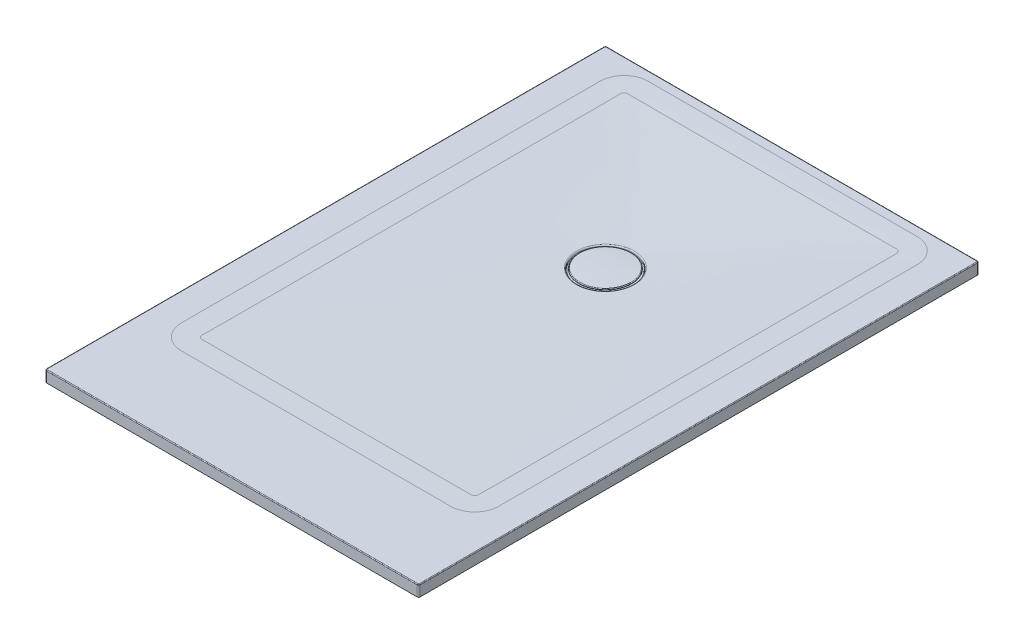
SolidWorks part; units mm, degrees
ref_plane "Płaszczyzna przednia" through (0, 0, 0) normal (0, 0, 1) x (1, 0, 0)
ref_plane "Płaszczyzna górna" through (0, 0, 0) normal (0, 1, 0) x (1, 0, 0)
ref_plane "Płaszczyzna prawa" through (0, 0, 0) normal (1, 0, 0) x (0, 0, -1)
sketch "Szkic2" plane through (0, 0, 0) normal (0, 1, 0) x (1, 0, 0)
  line L0 (0, 750) -> (0, 250) construction
  line L1 (-500, -750) -> (500, -750)
  line L2 (-500, -750) -> (-500, 750)
  line L3 (-500, 750) -> (500, 750)
  line L4 (500, -750) -> (500, 750)
  line L5 (-500, -750) -> (500, 750) construction
  line L6 (-500, 750) -> (500, -750) construction
  line L7 (-410, 710) -> (410, 710)
  line L8 (-410, 710) -> (-410, -510)
  line L9 (-410, -510) -> (410, -510)
  line L10 (410, 710) -> (410, -510)
  line L11 (-450, 750) -> (-450, -550) construction
  line L12 (-450, -550) -> (450, -550) construction
  line L13 (450, -550) -> (450, 750) construction
  circle A0 centre (0, 250) radius 75
  point P0 (0, 0)
  point P11 (0, 710)
  point P16 (0, -550)
  dimension "D9" = 150
  dimension "D1" = 1000
  dimension "D2" = 1500
  dimension "D3" = 40
  dimension "D4" = 90
  dimension "D5" = 40
  dimension "D6" = 50
  dimension "D7" = 1300
  dimension "D8" = 500
  dimension "D10" = 900
sketch "Szkic3" plane through (0, 0, 0) normal (0, 1, 0) x (1, 0, 0)
  line L0 (-500, -750) -> (-500, 750) construction
  line L1 (-500, -750) -> (500, -750) construction
  line L2 (500, -750) -> (500, 750) construction
  line L3 (-500, 750) -> (500, 750) construction
  line L4 (-410, 710) -> (-410, -510) construction
  line L5 (-410, 710) -> (410, 710) construction
  line L6 (410, 710) -> (410, -510) construction
  line L7 (-410, -510) -> (410, -510) construction
  line L8 (-500, -750) -> (-500, 750)
  line L9 (-500, -750) -> (500, -750)
  line L10 (500, -750) -> (500, 750)
  line L11 (-500, 750) -> (500, 750)
  line L12 (-410, 660) -> (-410, -460)
  line L13 (-360, 710) -> (360, 710)
  line L14 (410, 660) -> (410, -460)
  line L15 (-360, -510) -> (360, -510)
  arc A0 (410, 660) -> (360, 710) centre (360, 660) ccw
  arc A1 (-360, 710) -> (-410, 660) centre (-360, 660) ccw
  arc A2 (360, -510) -> (410, -460) centre (360, -460) ccw
  arc A3 (-360, -510) -> (-410, -460) centre (-360, -460) cw
  dimension "D1" = 50
surface "Powierzchnia-Płaszczyzna1" sketch "Szkic3"
sketch "Szkic4" plane through (0, 0, 0) normal (0, 1, 0) x (1, 0, 0)
  line L0 (-410, 710) -> (-410, -510) construction
  line L1 (-410, -510) -> (410, -510) construction
  line L2 (410, 710) -> (410, -510) construction
  line L3 (-410, 710) -> (410, 710) construction
  line L4 (-410, 710) -> (-410, -510)
  line L5 (-410, -510) -> (410, -510)
  line L6 (410, 710) -> (410, -510)
  line L7 (-410, 710) -> (410, 710)
ref_plane "korek" through (0, -15, 0) normal (0, 1, 0) x (-1, 0, 0)
sketch "Szkic5" plane through (0, -15, 0) normal (0, 1, 0) x (-1, 0, 0)
  circle A0 centre (0, -250) radius 75 construction
  circle A1 centre (0, -250) radius 75
surface "Powierzchnia-Wyciągnięcie po profilach2"
surface "Powierzchnia-Połącz1"
sketch "Szkic7" plane through (0, 0, 0) normal (0, 1, 0) x (1, 0, 0)
  line L27 (360, 670) -> (-360, 670)
  line L28 (-370, 660) -> (-370, -460)
  line L29 (-360, -470) -> (360, -470)
  line L30 (370, -460) -> (370, 660)
  line L31 (360, 670) -> (-360, 670)
  line L32 (-370, 660) -> (-370, -460)
  line L33 (-360, -470) -> (360, -470)
  line L34 (370, -460) -> (370, 660)
  line L35 (360, 725) -> (-360, 725)
  line L36 (-425, 660) -> (-425, -460)
  line L37 (-360, -525) -> (360, -525)
  line L38 (425, -460) -> (425, 660)
  line L39 (360, 725) -> (-360, 725)
  line L40 (-425, 660) -> (-425, -460)
  line L41 (-360, -525) -> (360, -525)
  line L42 (425, -460) -> (425, 660)
  arc A0 (370, -460) -> (360, -470) centre (360, -460) cw
  arc A1 (-370, -460) -> (-360, -470) centre (-360, -460) ccw
  arc A2 (370, 660) -> (360, 670) centre (360, 660) ccw
  arc A3 (-370, 660) -> (-360, 670) centre (-360, 660) cw
  spline S23 degree 3 poles (-592.8625, 390.015) (198.9197, 560.8421) (376.728, 627.1227) (369.7449, 662.2675) (369.6659, 662.5842) (369.4757, 663.212) (369.3642, 663.5241) (368.9881, 664.4319) (368.6814, 665.0061) (368.1377, 665.821) (367.9418, 666.0858) (367.5239, 666.5953) (367.3041, 666.8378) (366.6129, 667.5298) (366.1098, 667.9437) (365.2908, 668.4921) (365.007, 668.6624) (364.4301, 668.9711) (364.1356, 669.1106) (363.5345, 669.3602) (363.2279, 669.4704) (362.6025, 669.6609) (362.2822, 669.7416) (312.6399, 679.6772) (221.3123, 311.7847) (103.2556, -296.4722) knots -6.69122 -6.69122 -6.69122 -6.69122 0.125 0.125 0.1875 0.1875 0.25 0.25 0.375 0.375 0.4375 0.4375 0.5 0.5 0.625 0.625 0.6875 0.6875 0.75 0.75 0.8125 0.8125 0.875 0.875 10.419787 10.419787 10.419787 10.419787 only from (370, 660) to (360, 670)
  spline S24 degree 3 poles (-84.9957, -291.4411) (-254.1294, 479.995) (-325.4399, 677.0706) (-362.2675, 669.7449) (-362.5842, 669.6659) (-363.2121, 669.4758) (-363.5242, 669.3641) (-364.432, 668.9882) (-365.0061, 668.6813) (-366.0927, 667.9565) (-366.6073, 667.5346) (-367.5296, 666.6128) (-367.9435, 666.1098) (-368.492, 665.291) (-368.6623, 665.0071) (-368.9711, 664.4303) (-369.1105, 664.1357) (-369.3602, 663.5346) (-369.4703, 663.228) (-369.6609, 662.6026) (-369.7415, 662.2824) (-378.3024, 619.4425) (-108.4159, 545.9666) (601.6306, 423.5405) knots -7.020727 -7.020727 -7.020727 -7.020727 0.125 0.125 0.1875 0.1875 0.25 0.25 0.375 0.375 0.5 0.5 0.625 0.625 0.6875 0.6875 0.75 0.75 0.8125 0.8125 0.875 0.875 9.10244 9.10244 9.10244 9.10244 only from (-360, 670) to (-370, 660)
  spline S25 degree 3 poles (592.8624, -190.015) (-198.9197, -360.8421) (-376.728, -427.1227) (-369.7449, -462.2675) (-369.6659, -462.5842) (-369.4757, -463.212) (-369.3642, -463.5241) (-368.9881, -464.4319) (-368.6814, -465.0061) (-368.1377, -465.821) (-367.9418, -466.0858) (-367.5239, -466.5953) (-367.3041, -466.8378) (-366.6129, -467.5298) (-366.1098, -467.9437) (-365.2908, -468.4921) (-365.007, -468.6624) (-364.4301, -468.9711) (-364.1356, -469.1106) (-363.5345, -469.3602) (-363.2279, -469.4704) (-362.6025, -469.6609) (-362.2822, -469.7416) (-312.6399, -479.6772) (-221.3123, -111.7847) (-103.2556, 496.4721) knots -6.69122 -6.69122 -6.69122 -6.69122 0.125 0.125 0.1875 0.1875 0.25 0.25 0.375 0.375 0.4375 0.4375 0.5 0.5 0.625 0.625 0.6875 0.6875 0.75 0.75 0.8125 0.8125 0.875 0.875 10.419787 10.419787 10.419787 10.419787 only from (-370, -460) to (-360, -470)
  spline S26 degree 3 poles (84.9958, 491.4407) (254.1294, -279.995) (325.4399, -477.0706) (362.2675, -469.7449) (362.5842, -469.6659) (363.2121, -469.4758) (363.5242, -469.3641) (364.432, -468.9882) (365.0061, -468.6813) (366.0927, -467.9565) (366.6073, -467.5346) (367.5296, -466.6128) (367.9435, -466.1098) (368.492, -465.291) (368.6623, -465.0071) (368.9711, -464.4303) (369.1105, -464.1357) (369.3602, -463.5346) (369.4703, -463.228) (369.6609, -462.6026) (369.7415, -462.2824) (378.3024, -419.4425) (108.4159, -345.9666) (-601.6306, -223.5405) knots -7.020727 -7.020727 -7.020727 -7.020727 0.125 0.125 0.1875 0.1875 0.25 0.25 0.375 0.375 0.5 0.5 0.625 0.625 0.6875 0.6875 0.75 0.75 0.8125 0.8125 0.875 0.875 9.10244 9.10244 9.10244 9.10244 only from (360, -470) to (370, -460)
  spline S31 degree 3 poles (-2397.7125, -314.1078) (-135.5423, 239.9061) (456.1779, 509.4323) (423.3422, 674.7388) (422.8284, 676.7972) (421.9014, 679.8581) (421.5658, 680.8757) (420.8441, 682.8943) (420.4597, 683.8905) (418.4228, 688.808) (416.4286, 692.54) (413.4837, 696.9543) (412.8719, 697.8246) (411.6021, 699.5394) (410.9422, 700.3861) (408.9053, 702.8702) (407.4763, 704.4465) (402.9828, 708.9434) (399.7136, 711.634) (395.2774, 714.6044) (394.3699, 715.1802) (392.5354, 716.2814) (391.608, 716.8073) (388.7959, 718.3123) (386.8813, 719.2189) (382.9739, 720.8414) (380.9811, 721.5574) (377.9322, 722.4865) (376.906, 722.7721) (374.8333, 723.2938) (373.7849, 723.5305) (176.8731, 762.8836) (-120.1677, -108.547) (-543.7764, -2119.0486) knots -4.79003 -4.79003 -4.79003 -4.79003 0.125 0.125 0.1875 0.1875 0.21875 0.21875 0.25 0.25 0.375 0.375 0.40625 0.40625 0.4375 0.4375 0.5 0.5 0.625 0.625 0.65625 0.65625 0.6875 0.6875 0.75 0.75 0.8125 0.8125 0.84375 0.84375 0.875 0.875 6.70628 6.70628 6.70628 6.70628 only from (425, 660) to (360, 725)
  spline S32 degree 3 poles (616.6526, -2096.71) (63.1279, 157.3925) (-208.5431, 756.36) (-374.7389, 723.3422) (-376.7972, 722.8283) (-379.8582, 721.9015) (-380.8758, 721.5658) (-382.8944, 720.844) (-383.8906, 720.4597) (-388.8082, 718.4228) (-392.54, 716.4285) (-396.9544, 713.4836) (-397.8246, 712.8719) (-399.5394, 711.602) (-400.3862, 710.9422) (-402.8703, 708.9053) (-404.4465, 707.4763) (-408.9432, 702.9827) (-411.6339, 699.7136) (-414.6044, 695.2775) (-415.1801, 694.37) (-416.2813, 692.5355) (-416.8072, 691.6081) (-418.3123, 688.796) (-419.2187, 686.8815) (-420.8414, 682.9741) (-421.5573, 680.9812) (-422.4865, 677.9324) (-422.772, 676.9062) (-423.2938, 674.8335) (-423.5304, 673.7851) (-462.3656, 479.4196) (384.9365, 187.6454) (2421.4298, -236.2908) knots -4.816803 -4.816803 -4.816803 -4.816803 0.125 0.125 0.1875 0.1875 0.21875 0.21875 0.25 0.25 0.375 0.375 0.40625 0.40625 0.4375 0.4375 0.5 0.5 0.625 0.625 0.65625 0.65625 0.6875 0.6875 0.75 0.75 0.8125 0.8125 0.84375 0.84375 0.875 0.875 6.630395 6.630395 6.630395 6.630395 only from (-360, 725) to (-425, 660)
  spline S33 degree 3 poles (2397.7125, 514.1078) (135.5423, -39.9061) (-456.1779, -309.4323) (-423.3422, -474.7388) (-422.8284, -476.7972) (-421.9014, -479.8581) (-421.5658, -480.8757) (-420.8441, -482.8943) (-420.4597, -483.8905) (-418.4228, -488.808) (-416.4286, -492.54) (-413.4837, -496.9543) (-412.8719, -497.8246) (-411.6021, -499.5394) (-410.9422, -500.3861) (-408.9053, -502.8702) (-407.4763, -504.4465) (-402.9828, -508.9434) (-399.7136, -511.634) (-395.2774, -514.6044) (-394.3699, -515.1802) (-392.5354, -516.2814) (-391.608, -516.8073) (-388.7959, -518.3123) (-386.8813, -519.2189) (-382.9739, -520.8414) (-380.9811, -521.5574) (-377.9322, -522.4865) (-376.906, -522.7721) (-374.8333, -523.2938) (-373.7849, -523.5305) (-176.8731, -562.8836) (120.1677, 308.547) (543.7764, 2319.0486) knots -4.79003 -4.79003 -4.79003 -4.79003 0.125 0.125 0.1875 0.1875 0.21875 0.21875 0.25 0.25 0.375 0.375 0.40625 0.40625 0.4375 0.4375 0.5 0.5 0.625 0.625 0.65625 0.65625 0.6875 0.6875 0.75 0.75 0.8125 0.8125 0.84375 0.84375 0.875 0.875 6.70628 6.70628 6.70628 6.70628 only from (-425, -460) to (-360, -525)
  spline S34 degree 3 poles (-616.6526, 2296.7101) (-63.1279, 42.6075) (208.5431, -556.36) (374.7389, -523.3422) (376.7972, -522.8283) (379.8582, -521.9015) (380.8758, -521.5658) (382.8944, -520.844) (383.8906, -520.4597) (388.8082, -518.4228) (392.54, -516.4285) (396.9544, -513.4836) (397.8246, -512.8719) (399.5394, -511.602) (400.3862, -510.9422) (402.8703, -508.9053) (404.4465, -507.4763) (408.9432, -502.9827) (411.6339, -499.7136) (414.6044, -495.2775) (415.1801, -494.37) (416.2813, -492.5355) (416.8072, -491.6081) (418.3123, -488.796) (419.2187, -486.8815) (420.8414, -482.9741) (421.5573, -480.9812) (422.4865, -477.9324) (422.772, -476.9062) (423.2938, -474.8335) (423.5304, -473.7851) (462.3656, -279.4196) (-384.9365, 12.3546) (-2421.4298, 436.2908) knots -4.816803 -4.816803 -4.816803 -4.816803 0.125 0.125 0.1875 0.1875 0.21875 0.21875 0.25 0.25 0.375 0.375 0.40625 0.40625 0.4375 0.4375 0.5 0.5 0.625 0.625 0.65625 0.65625 0.6875 0.6875 0.75 0.75 0.8125 0.8125 0.84375 0.84375 0.875 0.875 6.630395 6.630395 6.630395 6.630395 only from (360, -525) to (425, -460)
  spline S35 degree 3 poles (425, 660) (425, 664.2918) (424.5791, 668.5118) (423.3422, 674.7388) (422.8284, 676.7972) (421.9014, 679.8581) (421.5658, 680.8757) (420.8441, 682.8943) (420.4597, 683.8905) (418.4228, 688.808) (416.4286, 692.54) (413.4837, 696.9543) (412.8719, 697.8246) (411.6021, 699.5394) (410.9422, 700.3861) (408.9053, 702.8702) (407.4763, 704.4465) (402.9828, 708.9434) (399.7136, 711.634) (395.2774, 714.6044) (394.3699, 715.1802) (392.5354, 716.2814) (391.608, 716.8073) (388.7959, 718.3123) (386.8813, 719.2189) (382.9739, 720.8414) (380.9811, 721.5574) (377.9322, 722.4865) (376.906, 722.7721) (374.8333, 723.2938) (373.7849, 723.5305) (368.5368, 724.5793) (364.2918, 725) (360, 725) knots 0 0 0 0 0.125 0.125 0.1875 0.1875 0.21875 0.21875 0.25 0.25 0.375 0.375 0.40625 0.40625 0.4375 0.4375 0.5 0.5 0.625 0.625 0.65625 0.65625 0.6875 0.6875 0.75 0.75 0.8125 0.8125 0.84375 0.84375 0.875 0.875 1 1 1 1
  spline S36 degree 3 poles (-360, 725) (-364.2918, 725) (-368.5119, 724.5794) (-374.7389, 723.3422) (-376.7972, 722.8283) (-379.8582, 721.9015) (-380.8758, 721.5658) (-382.8944, 720.844) (-383.8906, 720.4597) (-388.8082, 718.4228) (-392.54, 716.4285) (-396.9544, 713.4836) (-397.8246, 712.8719) (-399.5394, 711.602) (-400.3862, 710.9422) (-402.8703, 708.9053) (-404.4465, 707.4763) (-408.9432, 702.9827) (-411.6339, 699.7136) (-414.6044, 695.2775) (-415.1801, 694.37) (-416.2813, 692.5355) (-416.8072, 691.6081) (-418.3123, 688.796) (-419.2187, 686.8815) (-420.8414, 682.9741) (-421.5573, 680.9812) (-422.4865, 677.9324) (-422.772, 676.9062) (-423.2938, 674.8335) (-423.5304, 673.7851) (-424.579, 668.5368) (-425, 664.2918) (-425, 660) knots 0 0 0 0 0.125 0.125 0.1875 0.1875 0.21875 0.21875 0.25 0.25 0.375 0.375 0.40625 0.40625 0.4375 0.4375 0.5 0.5 0.625 0.625 0.65625 0.65625 0.6875 0.6875 0.75 0.75 0.8125 0.8125 0.84375 0.84375 0.875 0.875 1 1 1 1
  spline S37 degree 3 poles (-425, -460) (-425, -464.2918) (-424.5791, -468.5118) (-423.3422, -474.7388) (-422.8284, -476.7972) (-421.9014, -479.8581) (-421.5658, -480.8757) (-420.8441, -482.8943) (-420.4597, -483.8905) (-418.4228, -488.808) (-416.4286, -492.54) (-413.4837, -496.9543) (-412.8719, -497.8246) (-411.6021, -499.5394) (-410.9422, -500.3861) (-408.9053, -502.8702) (-407.4763, -504.4465) (-402.9828, -508.9434) (-399.7136, -511.634) (-395.2774, -514.6044) (-394.3699, -515.1802) (-392.5354, -516.2814) (-391.608, -516.8073) (-388.7959, -518.3123) (-386.8813, -519.2189) (-382.9739, -520.8414) (-380.9811, -521.5574) (-377.9322, -522.4865) (-376.906, -522.7721) (-374.8333, -523.2938) (-373.7849, -523.5305) (-368.5368, -524.5793) (-364.2918, -525) (-360, -525) knots 0 0 0 0 0.125 0.125 0.1875 0.1875 0.21875 0.21875 0.25 0.25 0.375 0.375 0.40625 0.40625 0.4375 0.4375 0.5 0.5 0.625 0.625 0.65625 0.65625 0.6875 0.6875 0.75 0.75 0.8125 0.8125 0.84375 0.84375 0.875 0.875 1 1 1 1
  spline S38 degree 3 poles (360, -525) (364.2918, -525) (368.5119, -524.5794) (374.7389, -523.3422) (376.7972, -522.8283) (379.8582, -521.9015) (380.8758, -521.5658) (382.8944, -520.844) (383.8906, -520.4597) (388.8082, -518.4228) (392.54, -516.4285) (396.9544, -513.4836) (397.8246, -512.8719) (399.5394, -511.602) (400.3862, -510.9422) (402.8703, -508.9053) (404.4465, -507.4763) (408.9432, -502.9827) (411.6339, -499.7136) (414.6044, -495.2775) (415.1801, -494.37) (416.2813, -492.5355) (416.8072, -491.6081) (418.3123, -488.796) (419.2187, -486.8815) (420.8414, -482.9741) (421.5573, -480.9812) (422.4865, -477.9324) (422.772, -476.9062) (423.2938, -474.8335) (423.5304, -473.7851) (424.579, -468.5368) (425, -464.2918) (425, -460) knots 0 0 0 0 0.125 0.125 0.1875 0.1875 0.21875 0.21875 0.25 0.25 0.375 0.375 0.40625 0.40625 0.4375 0.4375 0.5 0.5 0.625 0.625 0.65625 0.65625 0.6875 0.6875 0.75 0.75 0.8125 0.8125 0.84375 0.84375 0.875 0.875 1 1 1 1
  dimension "D3" = 10
  dimension "D1" = 40
  dimension "D2" = 15
other "Usuń ścianę1"
other "Granica-Powierzchnia1"
surface "Powierzchnia-Połącz2"
sketch "Szkic9" plane through (0, 0, 0) normal (0, 1, 0) x (1, 0, 0)
  line L0 (-500, -750) -> (500, -750) construction
  line L1 (-500, -750) -> (-500, 750) construction
  line L2 (500, -750) -> (500, 750) construction
  line L3 (-500, 750) -> (500, 750) construction
  line L4 (-500, -750) -> (500, -750)
  line L5 (-500, -750) -> (-500, 750)
  line L6 (500, -750) -> (500, 750)
  line L7 (-500, 750) -> (500, 750)
surface "Powierzchnia-Wyciągnięcie1" sketch "Szkic9" parameters "D1"=30
sketch "Szkic8" plane through (0, 0, 0) normal (1, 0, 0) x (0, 0, -1)
  line L0 (250, 0) -> (250, -30) construction
  line L1 (174.9999, -15) -> (175.2968, -23.5)
  line L4 (175.2968, -23.5) -> (198, -24.0945)
  line L5 (175.2968, -23.5) -> (250, -23.5) construction
  line L6 (198, -24.0945) -> (198, -30) construction
  line L7 (250, -30) -> (175.2968, -30) construction
  line L8 (175.2968, -30) -> (175.2968, -23.5) construction
  line L9 (205, -28) -> (205, -30)
  line L10 (198, -24.0945) -> (205, -28)
  dimension "D1" = 30
  dimension "D2" = 8.5
  dimension "D3" = 2
  dimension "D4" = 1.5
  dimension "D5" = 52
  dimension "D6" = 45
  dimension "D7" = 2
surface "Powierzchnia-Obrót1" sketch "Szkic8" parameters "D1"=360
surface "Powierzchnia-Płaszczyzna2"
surface "Powierzchnia-Połącz3"
fillet "Zaokrąglenie4" radius 4 4 edges at (-500, -15, -750) (500, -15, -750) (-500, -15, 750) (500, -15, 750)
fillet "Zaokrąglenie5" radius 3 3 edges at (0, -24.0945, -302) (0, -23.5, -324.7032)
fillet "Zaokrąglenie6" radius 2 9 edges at (498.8284, 0, 748.8284) (0, 0, 750) (-498.8284, 0, 748.8284) (-500, 0, 0) (-498.8284, 0, -748.8284) (0, 0, -750) (498.8284, 0, -748.8284) (500, 0, 0) (0, -28, -295)
sketch "Szkic11" plane through (0, 0, 0) normal (1, 0, 0) x (0, 0, -1)
  line L0 (250, 0) -> (250, -30) construction
  line L1 (-746, -30) -> (746, -30) construction
  line L2 (250, -17) -> (250, -11.5)
  line L14 (320, -11.5) -> (320, -14.5) construction
  line L16 (320, -17) -> (250, -17)
  line L18 (320, -17) -> (320, -16.3377)
  line L19 (250, -11.5) -> (320, -11.5) construction
  arc A0 (320, -16.3377) -> (318.1666, -14.3446) centre (318, -16.3377) ccw
  arc A6 (318.1666, -14.3446) -> (250, -11.5) centre (250, -829.6667) ccw
  dimension "D2" = 2
  dimension "D8" = 2.5
  dimension "D9" = 17
  dimension "D10" = 5.5
  dimension "D11" = 70
revolve "Obrót1" add sketch "Szkic11" angle 360 about L0
